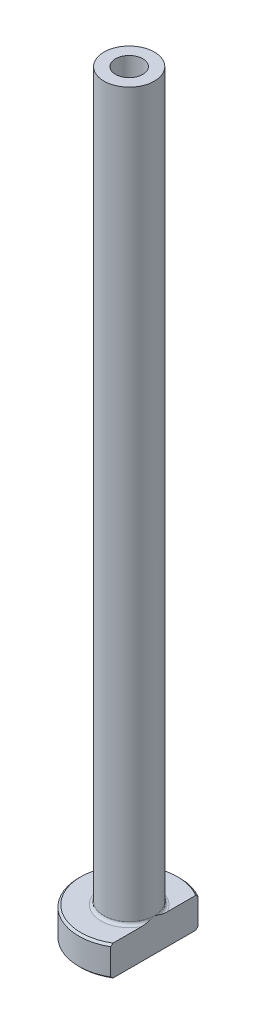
SolidWorks part; units mm, degrees
ref_plane "Front Plane" through (0, 0, 0) normal (0, 0, 1) x (1, 0, 0)
ref_plane "Top Plane" through (0, 0, 0) normal (0, 1, 0) x (1, 0, 0)
ref_plane "Right Plane" through (0, 0, 0) normal (1, 0, 0) x (0, 0, -1)
sketch "Sketch1" plane through (0, 0, 0) normal (0, 0, 1) x (1, 0, 0)
  line L0 (-1.35, 75) -> (-2.5, 75)
  line L1 (-2.5, 75) -> (-2.5, 3)
  line L2 (-2.5, 3) -> (-5, 3)
  line L3 (-5, 3) -> (-5, 0)
  line L4 (4.125, 0) -> (-4.125, 0) construction
  line L5 (-5, 0) -> (-1.6, 0)
  line L6 (-1.35, 30) -> (-1.35, 75)
  line L7 (0, 92.1877) -> (0, -15.5353) construction
  line L8 (0, -5.5) -> (0, 5.5) construction
  line L9 (-1.35, 30) -> (-1.6, 18)
  line L10 (-1.6, 18) -> (-1.6, 0)
  dimension "D1" = 0.25
  dimension "ID" = 2.7
  dimension "OD" = 5
  dimension "L" = 75
  dimension "H" = 10
  dimension "T" = 3
  dimension "N" = 45
  dimension "D2" = 12
  dimension "L-N" = 30
revolve "Revolve1" add sketch "Sketch1" angle 360 about L7
fillet "Fillet1" radius 0.3 1 edges at (0, 3, 2.5)
chamfer "Chamfer1" distance 0.2 angle 45 2 edges at (0, 3, 5) (0, 0, 5)
sketch "Sketch2" plane through (0, 0, 0) normal (0, -1, 0) x (1, 0, 0)
  line L0 (2.5, 4.3301) -> (2.5, -4.3301)
  circle A0 centre (0, 0) radius 5 construction
  arc A1 (2.5, 4.3301) -> (2.5, -4.3301) centre (0, 0) cw
  circle A2 centre (0, 0) radius 2.5 construction
extrude "Cut-Extrude1" cut sketch "Sketch2" against normal through all
chamfer "Chamfer2" distance 0.5 angle 45 1 edges at (0, 0, 1.6)
